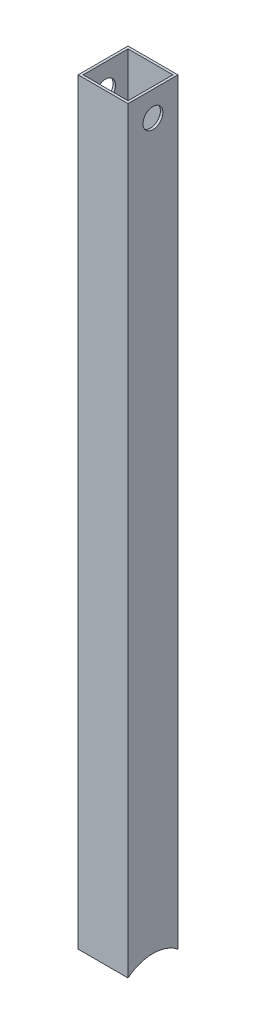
SolidWorks part; units mm, degrees
ref_plane "Front Plane" through (0, 0, 0) normal (0, 0, 1) x (1, 0, 0)
ref_plane "Top Plane" through (0, 0, 0) normal (0, 1, 0) x (1, 0, 0)
ref_plane "Right Plane" through (0, 0, 0) normal (1, 0, 0) x (0, 0, -1)
sketch "Sketch1" plane through (0, 0, 0) normal (0, 1, 0) x (1, 0, 0)
  line L1 (-25, 25) -> (25, 25)
  line L2 (-25, 25) -> (-25, -25)
  line L3 (-25, -25) -> (25, -25)
  line L4 (25, 25) -> (25, -25)
  line L5 (-25, 25) -> (25, -25) construction
  line L6 (-25, -25) -> (25, 25) construction
  point P0 (0, 0)
  dimension "D1" = 50
extrude "Boss-Extrude1" add sketch "Sketch1" along normal blind 790
shell "Shell1" thickness 2.5
sketch "Sketch2" plane through (25, 0, 0) normal (1, 0, 0) x (0, 0, -1)
  line L0 (0, 790) -> (0, 764.9926) construction
  line L1 (-25, 790) -> (25, 790) construction
  circle A0 centre (0, 764.9926) radius 10
  dimension "D1" = 20
extrude "Cut-Extrude1" cut sketch "Sketch2" against normal through all
sketch "Sketch3" plane through (25, 0, 0) normal (1, 0, 0) x (0, 0, -1)
  circle A0 centre (0, 0) radius 40
  dimension "D1" = 80
extrude "Cut-Extrude2" cut sketch "Sketch3" against normal through all
